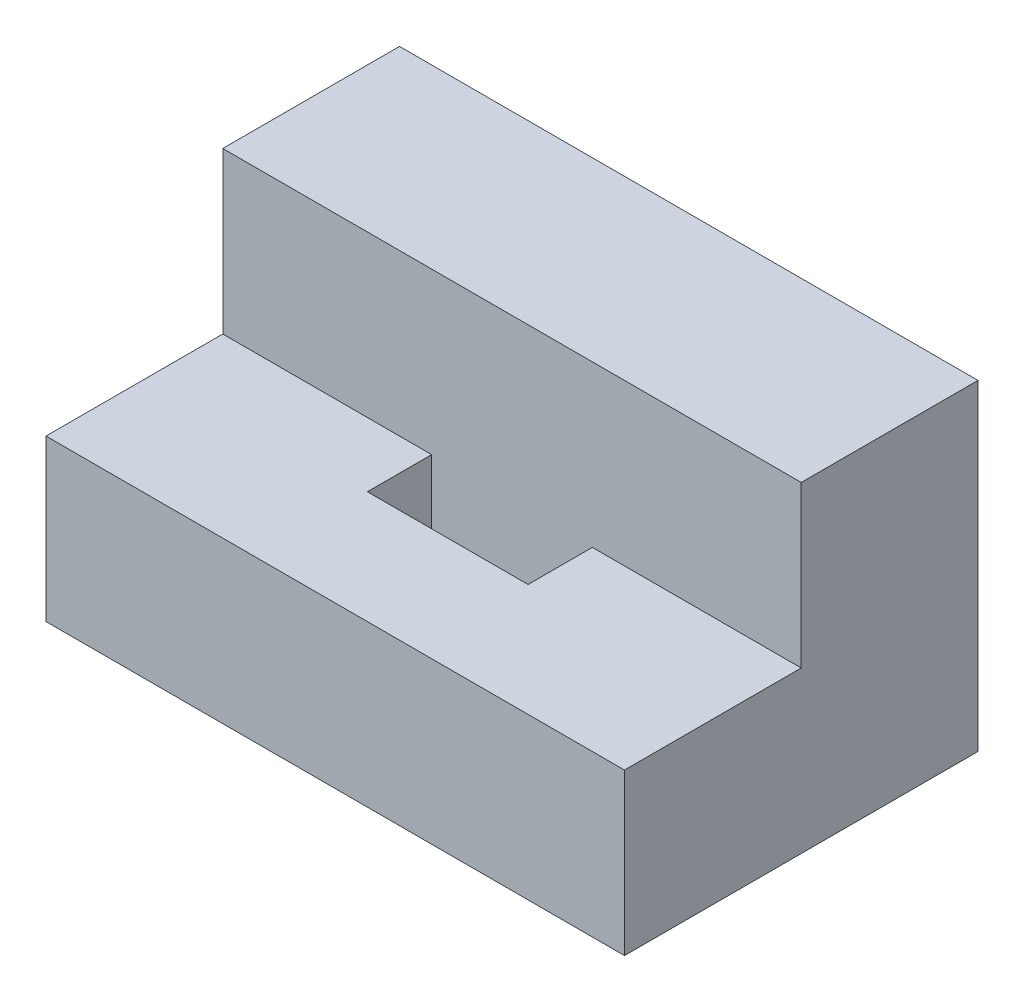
SolidWorks part; units mm, degrees
ref_plane "前视基准面" through (0, 0, 0) normal (0, 0, 1) x (1, 0, 0)
ref_plane "上视基准面" through (0, 0, 0) normal (0, 1, 0) x (1, 0, 0)
ref_plane "右视基准面" through (0, 0, 0) normal (1, 0, 0) x (0, 0, -1)
sketch "草图1" plane through (0, 0, 0) normal (0, 1, 0) x (1, 0, 0)
  line L1 (0, 0) -> (90, 0)
  line L2 (0, 0) -> (0, 55)
  line L3 (0, 55) -> (90, 55)
  line L4 (90, 0) -> (90, 55)
  dimension "D1" = 90
  dimension "D2" = 55
extrude "拉伸1" add sketch "草图1" along normal blind 25
sketch "草图2" plane through (0, 25, 0) normal (0, 1, 0) x (1, 0, 0)
  line L0 (90, 0) -> (90, 55) construction
  line L1 (0, 55) -> (90, 55)
  line L2 (0, 55) -> (0, 27.5)
  line L3 (0, 27.5) -> (90, 27.5)
  line L4 (90, 55) -> (90, 27.5)
extrude "拉伸2" add sketch "草图2" along normal blind 25
sketch "草图3" plane through (0, 25, 0) normal (0, 1, 0) x (1, 0, 0)
  line L0 (45, 27.5) -> (45, 37.7011) construction
  line L1 (0, 27.5) -> (90, 27.5) construction
  line L3 (32.5, 27.5) -> (57.5, 27.5)
  line L4 (32.5, 27.5) -> (32.5, 17.5)
  line L5 (32.5, 17.5) -> (57.5, 17.5)
  line L6 (57.5, 27.5) -> (57.5, 17.5)
  dimension "D1" = 25
  dimension "D2" = 10
extrude "切除-拉伸1" cut sketch "草图3" against normal through all
